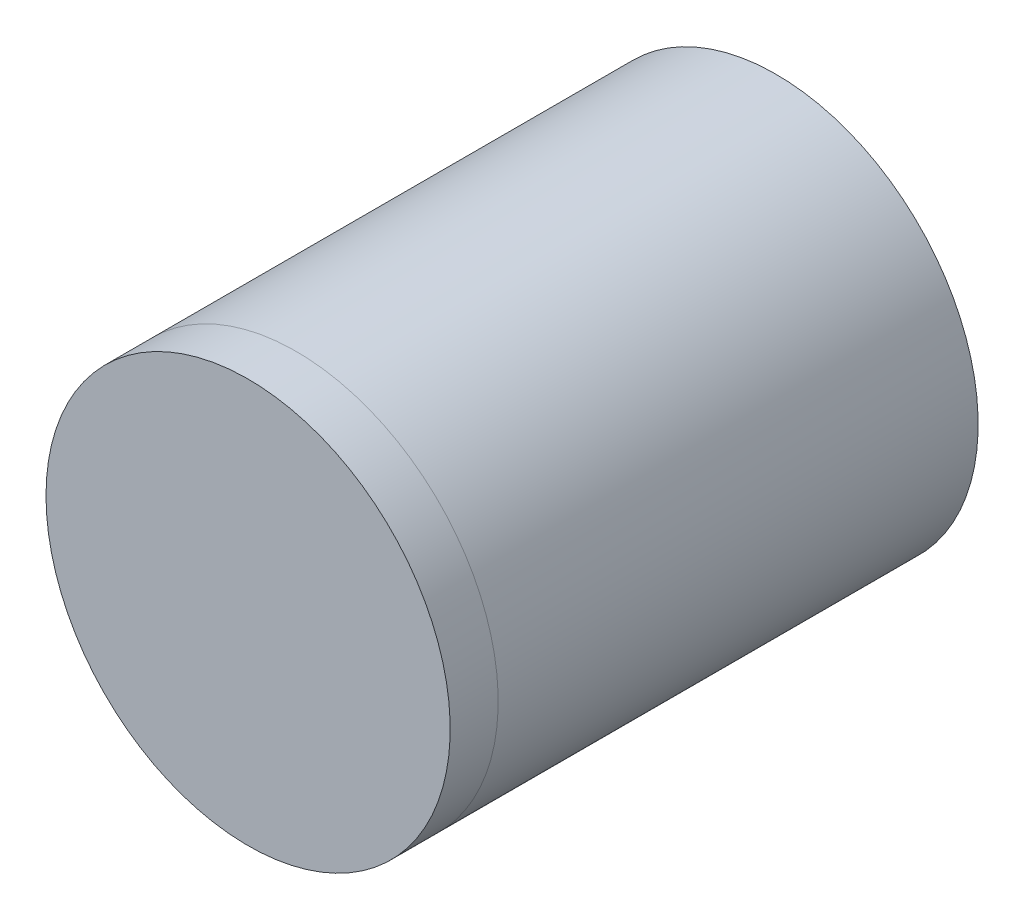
SolidWorks part; units mm, degrees
ref_plane "Plan1" through (0, 0, 0) normal (0, 0, 1) x (1, 0, 0)
ref_plane "Plan2" through (0, 0, 0) normal (0, 1, 0) x (1, 0, 0)
ref_plane "Plan3" through (0, 0, 0) normal (1, 0, 0) x (0, 0, -1)
sketch "EsquisseCorps" plane through (0, 0, 0) normal (0, 1, 0) x (1, 0, 0)
  line L0 (0, 0) -> (0, -20.899) construction
  line L1 (0, -18.999) -> (8.0005, -18.999)
  line L2 (0, -18.999) -> (0, -20.899)
  line L3 (0, -20.899) -> (8.0005, -20.899)
  line L4 (8.0005, -18.999) -> (8.0005, -20.899)
  dimension "LongueurHorsBroche" = 20.899
  dimension "LongueurCorps" = 1.9
  dimension "RayonCorps" = 8.0005
revolve "Base-Révolution" add sketch "EsquisseCorps" angle 360 about L0
sketch "Esquisse1" plane through (0, 0, 0) normal (0, 1, 0) x (1, 0, 0)
  line L0 (0, 0.001) -> (0, -18.999) construction
  line L1 (0, 0.001) -> (8, 0.001)
  line L2 (0, 0.001) -> (0, -18.999)
  line L3 (0, -18.999) -> (8, -18.999)
  line L4 (8, 0.001) -> (8, -18.999)
  line L5 (0, 12.3484) -> (0, -19.1197) construction
  dimension "Rayon" = 8
  dimension "LongueurUtile" = 19
  dimension "SurLongueur" = 0.001
revolve "Boss.-Révol.1" add sketch "Esquisse1" angle 360 about L0
sketch "Esquisse2" [suppressed] plane through (0, 0, 0) normal (0, 1, 0) x (1, 0, 0)
  line L0 (0, -12) -> (0, 7.4067)
  line L2 (20, -12) -> (0, -12)
  line L3 (0, 0) -> (0, -20) construction
  line L4 (0, 7.4067) -> (5.8225, 7.4067)
  line L5 (20, -10) -> (20, -12)
  line L6 (0, 0) -> (0, -12) construction
  line L7 (5.8225, 7.4067) -> (20, -10)
  dimension "LongueurUtile" = 19.4067
  dimension "Rayon2" = 20
  dimension "Rayon1" = 5.8225
  dimension "SurLongueur" = 7.4067
  dimension "LongueurCyl" = 2
revolve "Boss.-Révol.2" [suppressed] add sketch "Esquisse2" angle 360 about L6
sketch "Esquisse3" [suppressed] plane through (0, 0, 0) normal (0, 1, 0) x (1, 0, 0)
  line L0 (15, -10.438) -> (15, -14.0265)
  line L1 (0, 0) -> (0, -20) construction
  line L2 (0, 4.562) -> (0, -14.0265)
  line L3 (0, -14.0265) -> (15, -14.0265)
  line L4 (0, 4.562) -> (0, -14.0265) construction
  arc A0 (15, -10.438) -> (0, 4.562) centre (0, -10.438) ccw
  dimension "LongueurUtile" = 18.5885
  dimension "Rayon1" = 15
  dimension "SurLongueur" = 4.562
revolve "Boss.-Révol.3" [suppressed] add sketch "Esquisse3" angle 360 about L4
sketch "Esquisse4" [suppressed] plane through (0, 0, 0) normal (0, 1, 0) x (1, 0, 0)
  line L0 (0, -11.9602) -> (0, 1.9611)
  line L1 (0, 1.9611) -> (10.7931, 1.9611)
  line L2 (0, -11.9602) -> (10.7931, -11.9602)
  line L5 (0, 0) -> (0, -12.8248) construction
  arc A0 (10.7931, 1.9611) -> (10.7931, -11.9602) centre (10.7931, -4.9996) cw
  dimension "Rayon2" = 6.9606
  dimension "Rayon1" = 10.7931
  dimension "SurLongueur" = 1.9611
revolve "Boss.-Révol.4" [suppressed] add sketch "Esquisse4" angle 360 about L5
sketch "Esquisse5" [suppressed] plane through (0, 0, 0) normal (0, 1, 0) x (1, 0, 0)
  line L0 (0, 0) -> (0, -15.295)
  line L1 (0, 0) -> (0, -20) construction
  line L2 (0, 0) -> (6.1156, 0)
  line L3 (0, -15.295) -> (11.1156, -15.295)
  line L4 (11.1156, -15.295) -> (11.1156, -5)
  line L5 (0, -15.295) -> (0, 0) construction
  arc A0 (11.1156, -5) -> (6.1156, 0) centre (6.1156, -5) ccw
  dimension "Rayon2" = 5
  dimension "LongueurUtile" = 15.295
  dimension "Rayon1" = 11.1156
revolve "Boss.-Révol.5" [suppressed] add sketch "Esquisse5" angle 360 about L5
sketch "Esquisse6" [suppressed] plane through (0, 0, 0) normal (0, 1, 0) x (1, 0, 0)
  line L0 (0, -12.8875) -> (0, 5.1125)
  line L1 (0, 5.1125) -> (10.2661, 5.1125)
  line L2 (16.689, -3.8875) -> (10.2661, -12.8875)
  line L3 (10.2661, -12.8875) -> (0, -12.8875)
  line L4 (10.2661, 5.1125) -> (16.689, -3.8875)
  line L5 (0, 0) -> (0, -12.8875) construction
  dimension "LongueurUtile" = 18
  dimension "Rayon1" = 16.689
  dimension "Rayon2" = 10.2661
  dimension "DemiLongueur" = 9
  dimension "SurLongueur" = 5.1125
  dimension "Rayon3" = 10.2661
revolve "Boss.-Révol.6" [suppressed] add sketch "Esquisse6" angle 360 about L5
sketch "Esquisse7" [suppressed] plane through (0, 0, 0) normal (0, 1, 0) x (1, 0, 0)
  line L0 (0, 0) -> (2.1898, -1.2643)
  line L1 (2.1898, -1.2643) -> (2.1898, -3.8966)
  line L2 (2.1898, -3.8966) -> (7.0523, -12.3186)
  line L3 (0, 0) -> (0, -15.8125)
  line L4 (0, 0) -> (0, -20) construction
  line L5 (0, -10) -> (0, -20) construction
  line L6 (0, 0) -> (0, -15.8125) construction
  line L7 (0, -15.8125) -> (7.0523, -15.8125)
  line L8 (7.0523, -15.8125) -> (7.0523, -12.3186)
  dimension "Angle1" = 60
  dimension "Angle2" = 30
  dimension "LongueurUtile" = 15.8125
  dimension "Rayon2" = 2.1898
  dimension "Rayon1" = 7.0523
  dimension "LongueurCyl" = 3.4939
revolve "Boss.-Révol.7" [suppressed] add sketch "Esquisse7" angle 360 about L6
sketch "EsquisseADCYL" [suppressed] plane through (0, 0, 0) normal (0, 1, 0) x (1, 0, 0)
  line L0 (0, -19.99) -> (12.5, -19.99)
  line L1 (0, 0) -> (0, -55) construction
  line L2 (12.5, -19.99) -> (12.5, -35)
  line L3 (12.5, -35) -> (15, -35)
  line L4 (15, -35) -> (15, -45)
  line L5 (15, -45) -> (0, -45)
  line L6 (0, -45) -> (0, -19.99)
  line L7 (0, 0) -> (0, -45) construction
  dimension "Longueur1" = 15.01
  dimension "Longueur2" = 10
  dimension "Rayon1" = 12.5
  dimension "Rayon2" = 15
  dimension "Position" = 19.99
revolve "Adaptateur-Cylindrique" [suppressed] add sketch "EsquisseADCYL" angle 360 about L7
sketch "EsquisseADCONE" [suppressed] plane through (0, 0, 0) normal (0, 1, 0) x (1, 0, 0)
  line L0 (0, -19.99) -> (12.5, -19.99)
  line L1 (0, 0) -> (0, -55) construction
  line L2 (12.5, -19.99) -> (15, -35)
  line L3 (15, -35) -> (15, -45)
  line L4 (15, -45) -> (0, -45)
  line L5 (0, -45) -> (0, -19.99)
  line L6 (0, 0) -> (0, -45) construction
  dimension "Rayon1" = 12.5
  dimension "Rayon2" = 15
  dimension "Longueur2" = 10
  dimension "Longueur1" = 15.01
  dimension "Position" = 19.99
revolve "Adaptateur-Conique" [suppressed] add sketch "EsquisseADCONE" angle 360 about L6
sketch "EsquisseATCYL" [suppressed] plane through (0, 0, 0) normal (0, 1, 0) x (1, 0, 0)
  line L0 (0, -44.9) -> (20, -44.9)
  line L1 (0, 0) -> (0, -55) construction
  line L2 (20, -44.9) -> (20, -64.91)
  line L3 (20, -64.91) -> (25, -64.91)
  line L4 (25, -64.91) -> (25, -84.91)
  line L5 (25, -84.91) -> (0, -84.91)
  line L6 (0, -84.91) -> (0, -44.9)
  line L7 (0, -84.91) -> (0, 0) construction
  dimension "Rayon1" = 20
  dimension "Rayon2" = 25
  dimension "Longueur1" = 20.01
  dimension "Longueur2" = 20
  dimension "Position" = 44.9
revolve "Attachement-Cylindrique" [suppressed] add sketch "EsquisseATCYL" angle 360 about L7
sketch "EsquisseATCONE" [suppressed] plane through (0, 0, 0) normal (0, 1, 0) x (1, 0, 0)
  line L0 (0, -24.3219) -> (7.3421, -24.3219)
  line L1 (0, 0) -> (0, -55) construction
  line L2 (7.3421, -24.3219) -> (13.3823, -31.8202)
  line L3 (13.3823, -31.8202) -> (13.3823, -41.193)
  line L4 (13.3823, -41.193) -> (0, -41.193)
  line L5 (0, -41.193) -> (0, -24.3219)
  line L6 (0, -41.193) -> (0, 0) construction
  dimension "Rayon1" = 7.3421
  dimension "Rayon2" = 13.3823
  dimension "Longueur1" = 7.4983
  dimension "Longueur2" = 9.3728
  dimension "Position" = 24.3219
revolve "Attachement-Conique" [suppressed] add sketch "EsquisseATCONE" angle 360 about L6
